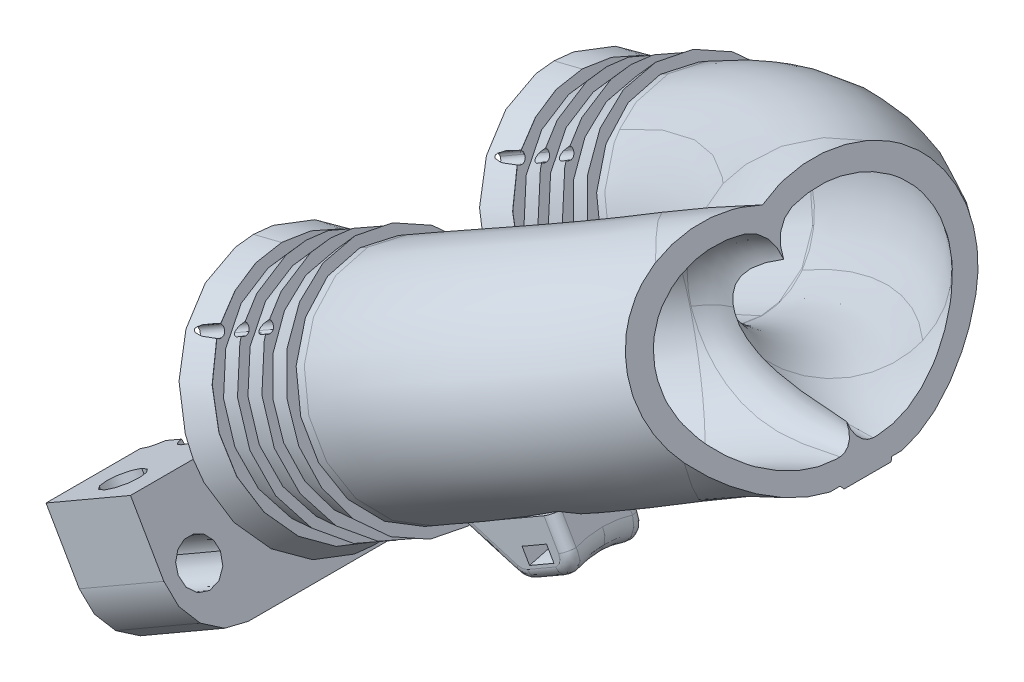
SolidWorks part; units mm, degrees
other "V9-623 - ws7040 splitter.step_1[1]"
ref_plane "Спереди" through (0, 0, 0) normal (0, 0, 1) x (1, 0, 0)
ref_plane "Сверху" through (0, 0, 0) normal (0, 1, 0) x (1, 0, 0)
ref_plane "Справа" through (0, 0, 0) normal (1, 0, 0) x (0, 0, -1)
other "Configuration Table"
imported_body "Импортированный1"
ref_plane "Плоскость1" through (-28.4622, -16.4327, 0) normal (-0.866, -0.5, 0) x (0, 0, 1)
split "Разделить1" trim tools "Плоскость1" bodies to split 103 resulting bodies 104 105
sketch3d "Трехмерный эскиз1"
  line L0 (-55.3696, 30.1723, -0.0004) -> (-44.1877, 10.8048, 0)
  line L1 (-44.1877, 10.8048, -2.5) -> (-44.1877, 10.8048, 2.5) construction
  line L2 (-87.1618, 5.238, 0) -> (-44.1877, 10.8048, 0)
  line L3 (-87.1618, 5.238, -3.161) -> (-87.1618, 5.238, 3.161) construction
  line L4 (-87.1618, 5.238, 0) -> (-55.3696, 30.1723, -0.0004)
ref_plane "Плоскость2" through (0, 0, 0.0003) normal (0, 0, 1) x (1, 0, 0)
